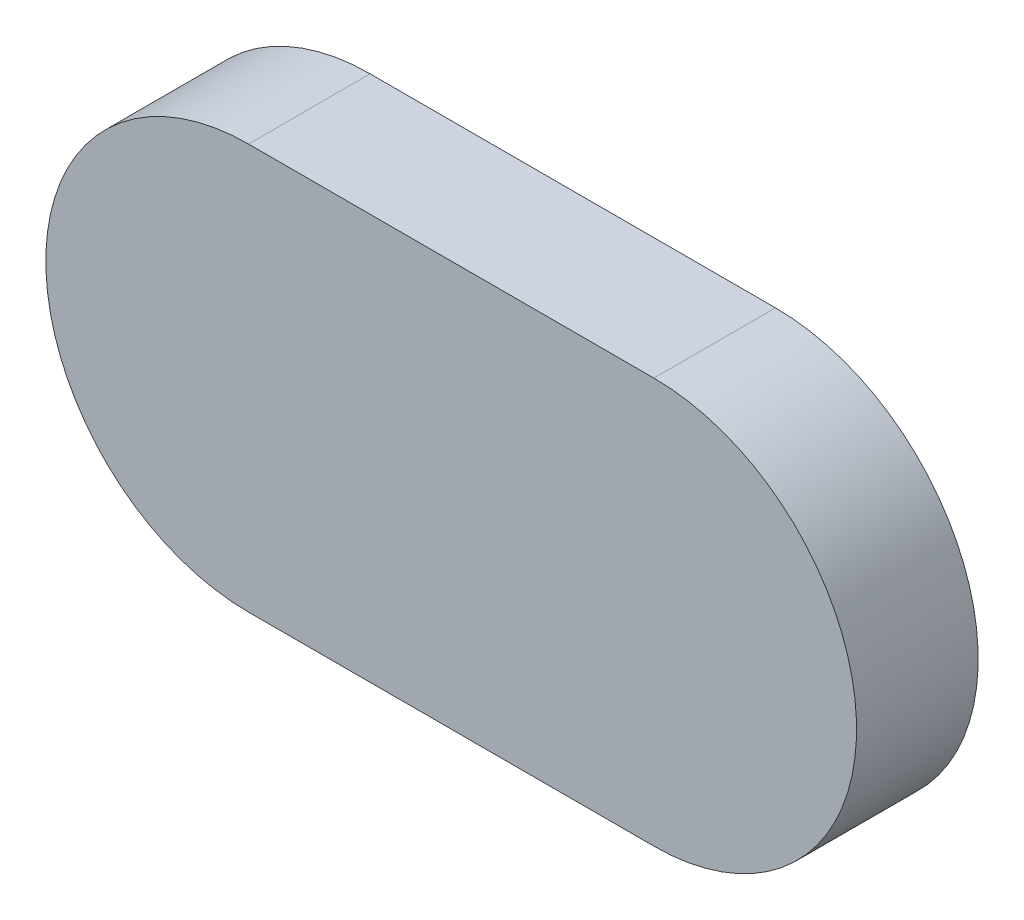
SolidWorks part; units mm, degrees
ref_plane "Plan de face" through (0, 0, 0) normal (0, 0, 1) x (1, 0, 0)
ref_plane "Plan de dessus" through (0, 0, 0) normal (0, 1, 0) x (1, 0, 0)
ref_plane "Plan de droite" through (0, 0, 0) normal (1, 0, 0) x (0, 0, -1)
sketch "Esquisse1" plane through (0, 0, 0) normal (0, 0, 1) x (1, 0, 0)
  line L0 (0, 0) -> (5, 0) construction
  line L1 (0, 2.5) -> (5, 2.5)
  line L2 (0, -2.5) -> (5, -2.5)
  arc A0 (0, 2.5) -> (0, -2.5) centre (0, 0) ccw
  arc A1 (5, -2.5) -> (5, 2.5) centre (5, 0) ccw
  point P3 (2.5, 0)
  dimension "D1" = 5
  dimension "D2" = 5
extrude "Boss.-Extru.1" add sketch "Esquisse1" along normal blind 1.5
sketch "Esquisse2" plane through (0, 0, 0) normal (0, 0, -1) x (-1, 0, 0)
  line L0 (-5.3054, 0) -> (0, 0) construction
  line L1 (-2.5, 2.5) -> (-2.5, -2.5) construction
  line L2 (-5, 2.5) -> (0, 2.5) construction
  line L3 (0, -2.5) -> (-5, -2.5) construction
